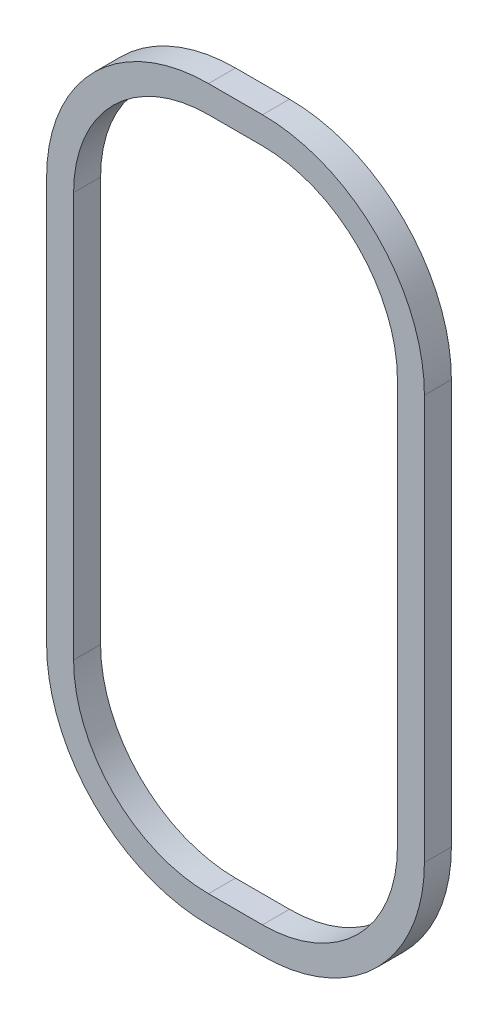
SolidWorks part; units mm, degrees
ref_plane "Plan de face" through (0, 0, 0) normal (0, 0, 1) x (1, 0, 0)
ref_plane "Plan de dessus" through (0, 0, 0) normal (0, 1, 0) x (1, 0, 0)
ref_plane "Plan de droite" through (0, 0, 0) normal (1, 0, 0) x (0, 0, -1)
sketch "Esquisse1" plane through (0, 0, 0) normal (0, 0, 1) x (1, 0, 0)
  line L0 (5, 26) -> (7, 26)
  line L1 (5, 0) -> (7, 0)
  line L2 (0, 5) -> (0, 20)
  line L3 (5, 25) -> (7, 25)
  line L4 (12, 5) -> (12, 20)
  line L5 (13, 5) -> (13, 20)
  line L6 (5, -1) -> (7, -1)
  line L7 (-1, 5) -> (-1, 20)
  arc A0 (5, 0) -> (0, 5) centre (5, 5) cw
  arc A1 (7, 0) -> (12, 5) centre (7, 5) ccw
  arc A2 (7, 25) -> (12, 20) centre (7, 20) cw
  arc A3 (0, 20) -> (5, 25) centre (5, 20) cw
  arc A4 (-1, 20) -> (5, 26) centre (5, 20) cw
  arc A5 (7, 26) -> (13, 20) centre (7, 20) cw
  arc A6 (7, -1) -> (13, 5) centre (7, 5) ccw
  arc A7 (5, -1) -> (-1, 5) centre (5, 5) cw
  point P7 (0, 0)
  point P12 (12, 25)
  point P15 (0, 25)
  dimension "D3" = 5
  dimension "D1" = 25
  dimension "D2" = 12
  dimension "D4" = 1
extrude "Boss.-Extru.1" add sketch "Esquisse1" along normal blind 1
